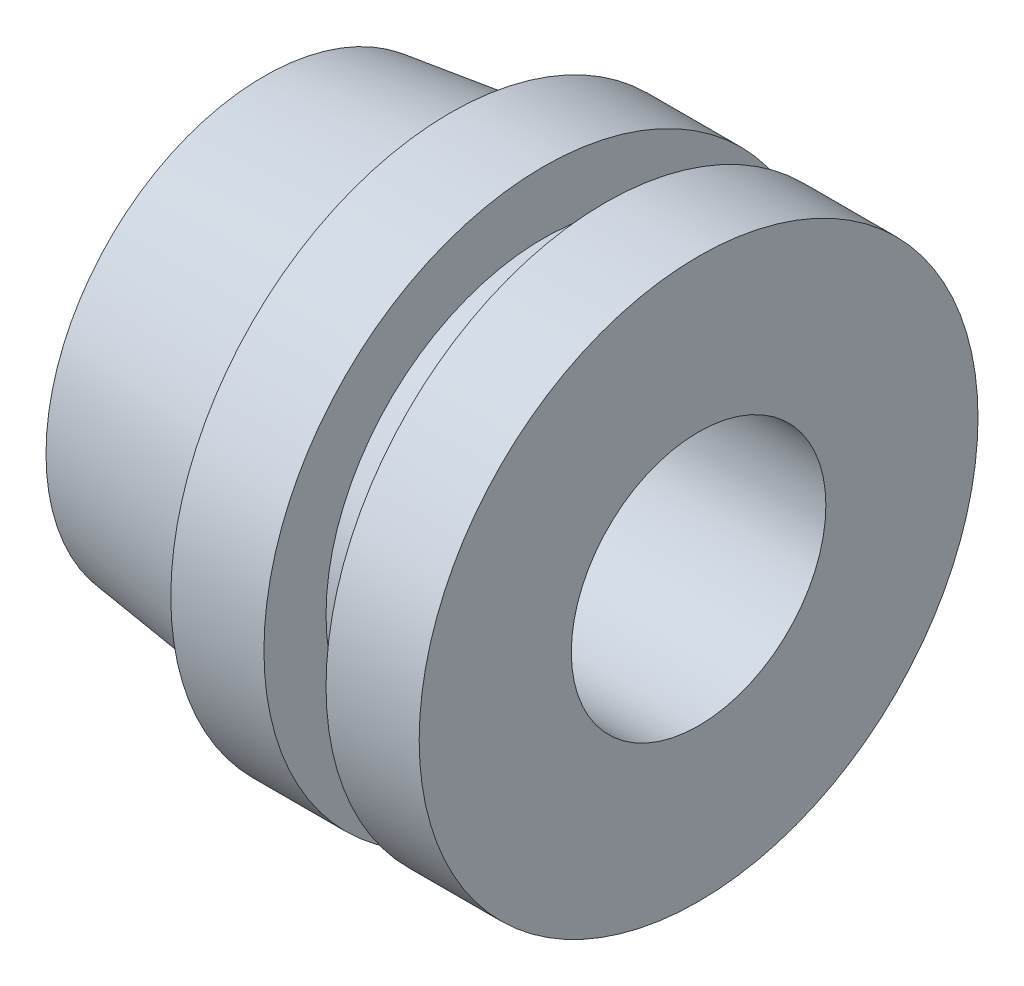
SolidWorks part; units mm, degrees
ref_plane "X_Y" through (0, 0, 0) normal (0, 0, 1) x (1, 0, 0)
ref_plane "Z_X" through (0, 0, 0) normal (0, 1, 0) x (1, 0, 0)
ref_plane "Y_Z" through (0, 0, 0) normal (1, 0, 0) x (0, 0, -1)
sketch "Sketch2" plane through (0, 0, 0) normal (0, 0, 1) x (1, 0, 0)
  line L0 (-109.0615, 0) -> (5344.0137, 0) construction
  line L1 (0, -1) -> (-3.5, -1)
  line L2 (-3.5, -1) -> (-3.5, -1.755)
  line L3 (-3.5, -1.755) -> (-2, -1.95)
  line L4 (-2, -1.95) -> (-2, -2.25)
  line L5 (-2, -2.25) -> (-1.25, -2.25)
  line L6 (-1.25, -2.25) -> (-1.25, -1.75)
  line L7 (-1.25, -1.75) -> (-0.75, -1.75)
  line L8 (-0.75, -1.75) -> (-0.75, -2.25)
  line L9 (-0.75, -2.25) -> (0, -2.25)
  line L10 (0, -2.25) -> (0, -1)
  dimension "D1" = 3.5
  dimension "D2" = 4.5
  dimension "D3" = 3.9
  dimension "D4" = 3.51
  dimension "D5" = 2
  dimension "D6" = 0.75
  dimension "D7" = 1.25
  dimension "D8" = 2
  dimension "D9" = 3.5
revolve "Revolve1" add sketch "Sketch2" angle 360 about L0
hole_wizard "M2.5x0.45 Tapped Hole1" positions "Sketch3" profile "Sketch4" tap size "M2.5x0.45" standard "ANSI Metric"
sketch "Sketch3" plane through (0, 0, 0) normal (1, 0, 0) x (0, 0, -1)
  point P0 (0, 0)
sketch "Sketch4" plane through (0, 0, 0) normal (0, 1, 0) x (0, 0, -1)
  line L0 (0, 0) -> (0, 3.5)
  line L1 (0, 3.5) -> (1.025, 3.5)
  line L2 (1.025, 3.5) -> (1.025, 0)
  line L5 (1.025, 0) -> (0, 0)
  line L11 (0, -6.35) -> (0, 107.95) construction
  dimension "Thru Tap Drill Dia." = 2.05
  dimension "Thru Tap Drill Depth" = 3.5
imported_body "Imported1" [suppressed]
